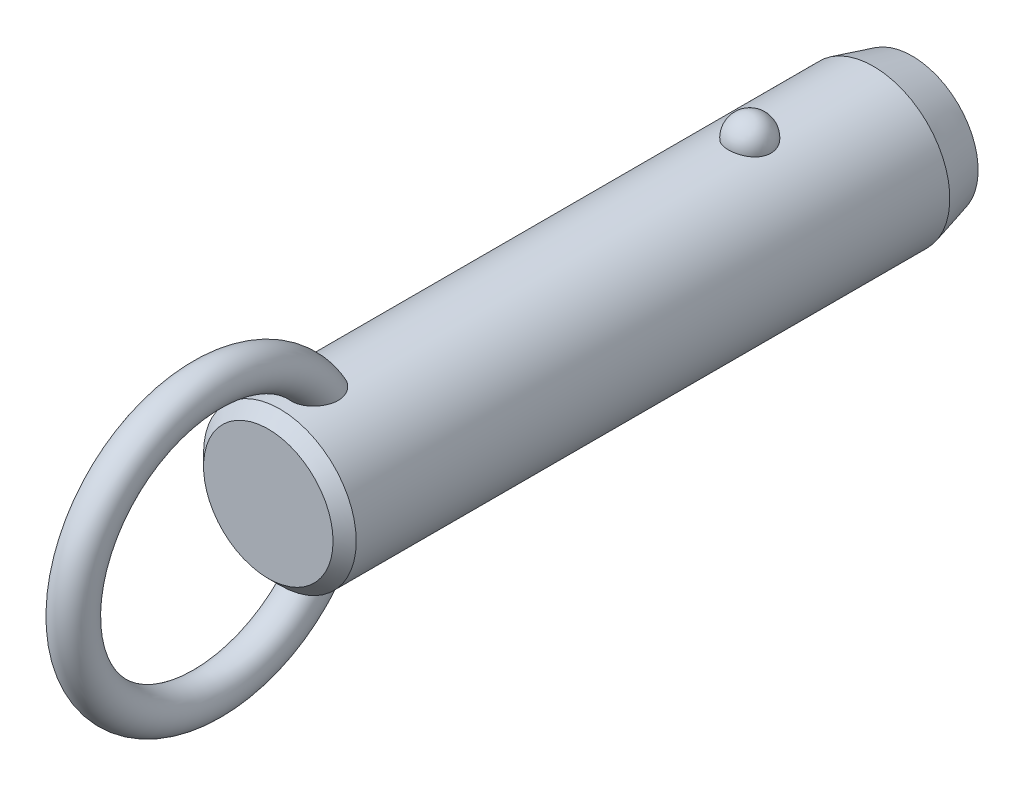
SolidWorks part; units mm, degrees
ref_plane "Front Plane" through (0, 0, 0) normal (0, 0, 1) x (1, 0, 0)
ref_plane "Top Plane" through (0, 0, 0) normal (0, 1, 0) x (1, 0, 0)
ref_plane "Right Plane" through (0, 0, 0) normal (1, 0, 0) x (0, 0, -1)
sketch "Sketch2" plane through (0, 0, 0) normal (0, 0, 1) x (1, 0, 0)
  circle A0 centre (0, 0) radius 7.9
  point P3 (0, 7.9)
  dimension "D1" = 15.8
extrude "Boss-Extrude1" add sketch "Sketch2" along normal blind 38.1
sketch "Sketch3" plane through (0, 0, 0) normal (0, 0, -1) x (-1, 0, 0)
  circle A0 centre (0, 0) radius 7.9
  dimension "D1" = 15.8
extrude "Boss-Extrude2" add sketch "Sketch3" along normal blind 19
chamfer "Chamfer1" distance 4 angle 15 1 edges at (-7.9, 0, -19)
sketch "Sketch12" plane through (0, 0, 0) normal (1, 0, 0) x (0, 0, -1)
  line L0 (-38.1, 7.9) -> (-38.1, -7.9) construction
  point P0 (-38.1, 0)
sketch "Sketch13" plane through (0, 0, 0) normal (1, 0, 0) x (0, 0, -1)
  circle A0 centre (-53.95, 0) radius 15.85
  point P2 (-38.1, 0)
  dimension "D1" = 31.7
sketch "Sketch14" plane through (0, 0, 0) normal (0, 1, 0) x (1, 0, 0)
  circle A0 centre (0, -40.1) radius 2
  point P2 (0, -38.1)
  dimension "D1" = 4
sweep "Sweep1" add profiles "Sketch14" path "Sketch13"
sketch "Sketch15" plane through (0, 0, 38.1) normal (0, 0, 1) x (1, 0, 0)
  circle A0 centre (0, 0) radius 7.9
  dimension "D1" = 15.8
extrude "Boss-Extrude3" add sketch "Sketch15" along normal blind 9.52
chamfer "Chamfer2" distance 1.2 angle 45 1 edges at (7.9, 0, 47.62)
sketch "Sketch18" plane through (0, 0, 0) normal (1, 0, 0) x (0, 0, -1)
  line L0 (15, 7.9) -> (-40.2091, 7.9) construction
  line L1 (2.2, 10.1) -> (2.2, 5.7)
  line L2 (-40.2091, -7.9) -> (15, -7.9) construction
  arc A0 (2.2, 10.1) -> (2.2, 5.7) centre (2.2, 7.9) ccw
  point P4 (0, 7.9)
  dimension "D1" = 18
revolve "Revolve1" add sketch "Sketch18" angle 360 about L1
